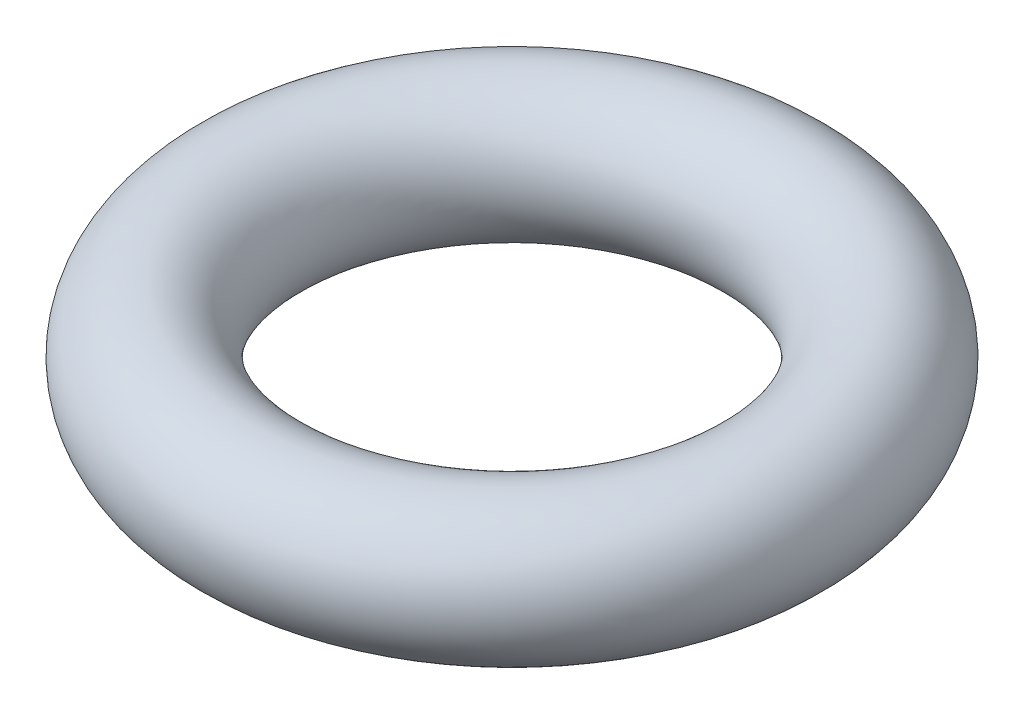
SolidWorks part; units mm, degrees
ref_plane "前视基准面" through (0, 0, 0) normal (0, 0, 1) x (1, 0, 0)
ref_plane "上视基准面" through (0, 0, 0) normal (0, 1, 0) x (1, 0, 0)
ref_plane "右视基准面" through (0, 0, 0) normal (1, 0, 0) x (0, 0, -1)
sketch "草图1" plane through (0, 0, 0) normal (0, 1, 0) x (1, 0, 0)
  circle A0 centre (0, 0) radius 30
  dimension "D1" = 60
sketch "草图3" plane through (0, 0, 0) normal (0, 0, 1) x (1, 0, 0)
  line L0 (30, 0) -> (-30, 0) construction
  circle A0 centre (-30, 0) radius 8
  dimension "D1" = 16
sweep "扫描3" add profiles "草图3" path "草图1"
